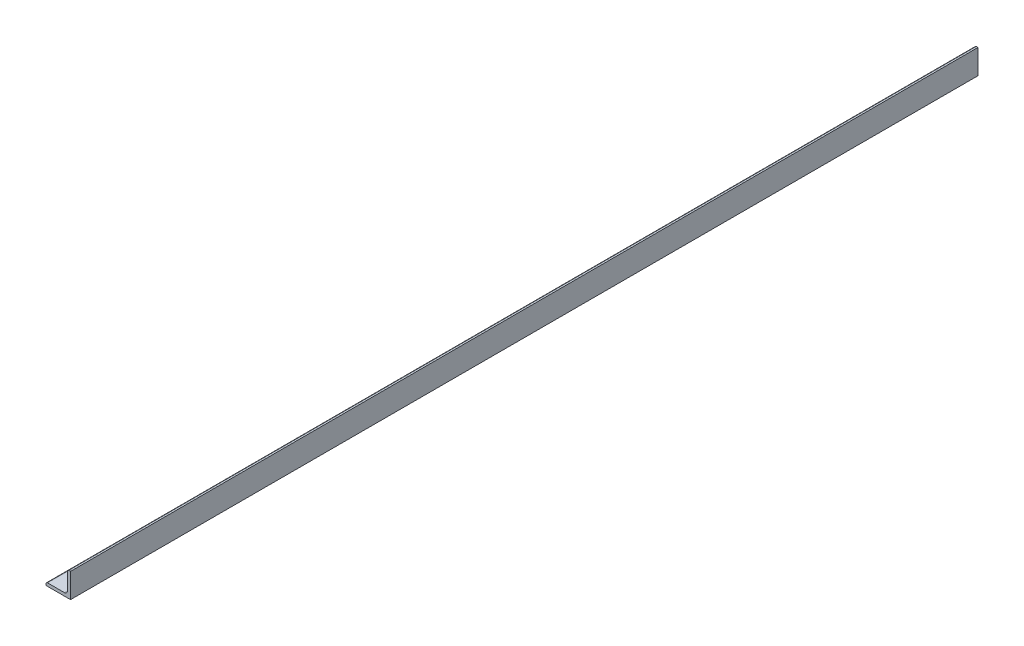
SolidWorks part; units mm, degrees
ref_plane "Front Plane" through (0, 0, 0) normal (0, 0, 1) x (1, 0, 0)
ref_plane "Top Plane" through (0, 0, 0) normal (0, 1, 0) x (1, 0, 0)
ref_plane "Right Plane" through (0, 0, 0) normal (1, 0, 0) x (0, 0, -1)
sketch "Sketch0" plane through (0, 0, 0) normal (0, 0, 1) x (1, 0, 0)
  line L0 (-6.35, -6.35) -> (6.35, -6.35)
  line L1 (6.35, -6.35) -> (6.35, 6.35)
  line L2 (6.35, 0) -> (0, 0) construction
  line L3 (0, 0) -> (0, -6.35) construction
  line L4 (4.7625, -3.1877) -> (4.7625, 6.35) construction
  line L5 (3.1877, -4.7625) -> (-6.35, -4.7625) construction
  arc A0 (4.7625, -3.1877) -> (3.1877, -4.7625) centre (3.1877, -3.1877) cw
  point P3 (4.3013, -4.3013)
sketch "Sketch1" plane through (0, 0, 0) normal (1, 0, 0) x (0, 0, -1)
  line L0 (234.95, 0) -> (-234.95, 0)
  point P4 (0, 0)
sketch "Sketch2" plane through (0, 0, 0) normal (0, 0, 1) x (1, 0, 0)
  line L0 (-6.35, -6.35) -> (6.35, -6.35)
  line L1 (6.35, -6.35) -> (6.35, 6.35)
  line L2 (6.35, 6.35) -> (4.7625, 6.35) construction
  line L3 (4.7625, 5.5563) -> (4.7625, -3.1877)
  line L4 (3.1877, -4.7625) -> (-5.5563, -4.7625)
  line L5 (-6.35, -6.35) -> (-6.35, -4.7625) construction
  line L6 (5.5563, 6.35) -> (6.35, 6.35)
  line L7 (-6.35, -5.5563) -> (-6.35, -6.35)
  line L8 (6.35, 0) -> (0, 0) construction
  line L9 (0, 0) -> (0, -6.35) construction
  arc A0 (4.7625, 5.5563) -> (5.5563, 6.35) centre (5.5563, 5.5563) cw
  arc A1 (-6.35, -5.5563) -> (-5.5563, -4.7625) centre (-5.5563, -5.5563) cw
  arc A2 (4.7625, -3.1877) -> (3.1877, -4.7625) centre (3.1877, -3.1877) cw
extrude "Boss-Extrude1" add sketch "Sketch2" along normal mid plane 469.9
sketch "Break Locations" plane through (0, 0, 0) normal (1, 0, 0) x (0, 0, -1)
  line L0 (-221.996, 0) -> (221.996, 0)
  line L1 (-234.95, -6.35) -> (-234.95, 6.35) construction
  line L2 (234.95, -6.35) -> (234.95, 6.35) construction
  point P0 (-224.155, 0)
  point P1 (224.155, 0)
  point P10 (0, 0)
  point P11 (221.996, 0)
  point P13 (-221.996, 0)
equation "\"D1@Break Locations\" = .85 * \"Height@Sketch2\""
equation "\"D2@Break Locations\"=\"D1@Break Locations\""
equation "\"Thickness@Sketch2\"=\"wall thickness@sketch0\""
equation "\"Height@Sketch2\"=\"outside height@sketch0\""
equation "\"Width@Sketch2\"=\"outside width@sketch0\""
equation "\"Inside Radius@Sketch2\"=\"inside corner radius@sketch0\""
equation "\"Length@Boss-Extrude1\"=\"length@sketch1\""
equation "\"D3@Break Locations\"=\"D2@Break Locations\"*1.2"
equation "\"D1@Sketch0\"=\"Wall Thickness@Sketch0\""
